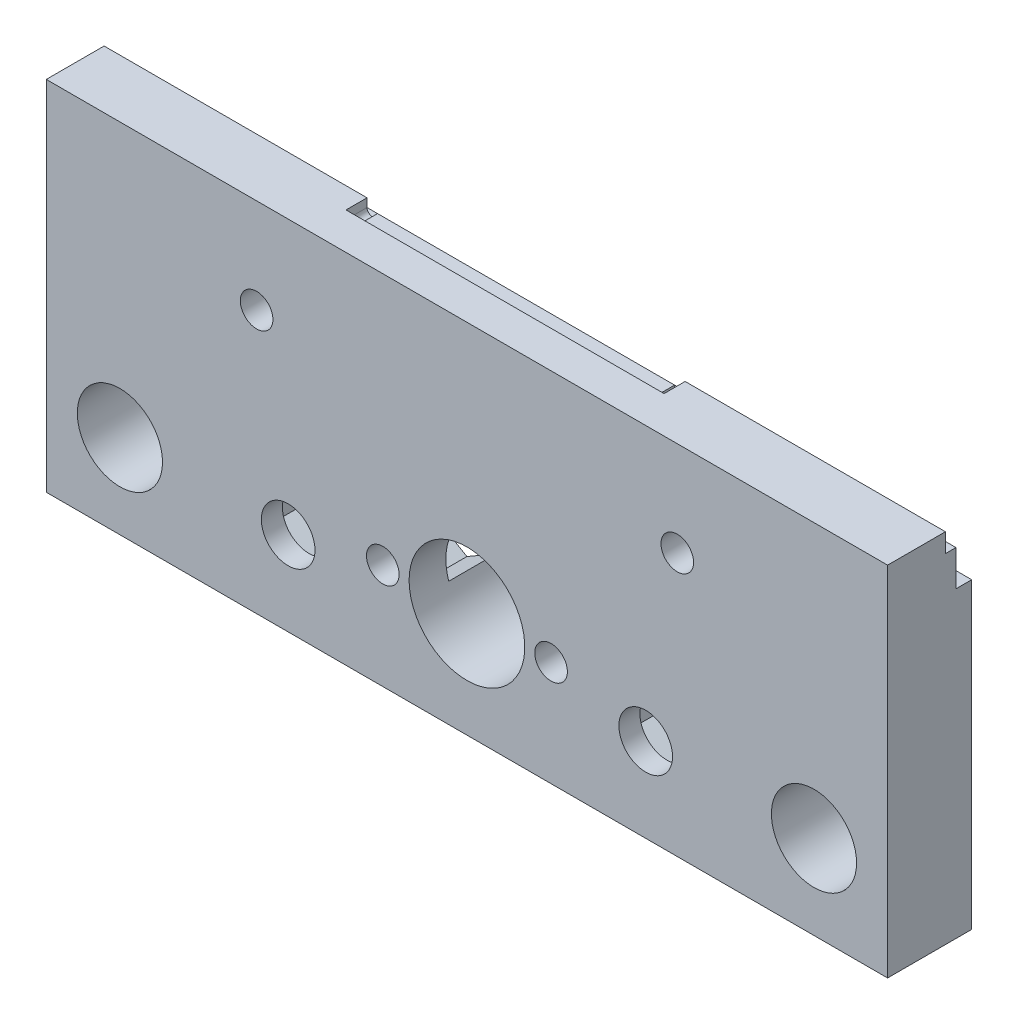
SolidWorks part; units mm, degrees
ref_plane "前视基准面" through (0, 0, 0) normal (0, 0, 1) x (1, 0, 0)
ref_plane "上视基准面" through (0, 0, 0) normal (0, 1, 0) x (1, 0, 0)
ref_plane "右视基准面" through (0, 0, 0) normal (1, 0, 0) x (0, 0, -1)
sketch "前视图草图" plane through (0, 0, 0) normal (0, 0, 1) x (1, 0, 0)
  line L0 (0, 0) -> (44.4821, 0) construction
  line L1 (0, 0) -> (0, 28.3185) construction
sketch "草图2" plane through (0, 0, 0) normal (0, 0, 1) x (1, 0, 0)
  line L0 (0, 0) -> (80, 0)
  line L1 (-200000, 0) -> (200044.4821, 0) construction
  line L2 (80, 0) -> (80, 34)
  line L3 (80, 34) -> (0, 34)
  line L4 (0, -200000) -> (0, 200028.3185) construction
  line L5 (0, 34) -> (0, 0)
  circle A0 centre (7, 8) radius 4.05
  circle A1 centre (40, 10) radius 4.05
  circle A2 centre (73, 8) radius 4.05
  dimension "D3" = 8
  dimension "D5" = 10
  dimension "D9" = 8.1
  dimension "D10" = 8.1
  dimension "D11" = 8.1
  dimension "D1" = 34
  dimension "D2" = 80
  dimension "D4" = 7
  dimension "D6" = 7
  dimension "D7" = 8
  dimension "D8" = 40
extrude "凸台-拉伸1" add sketch "草图2" along normal blind 8
sketch "草图3" plane through (0, 0, 8) normal (0, 0, 1) x (1, 0, 0)
  line L0 (16.088, 8) -> (31.4805, 8) construction
  line L1 (7, 8) -> (7, 16.8386) construction
  line L2 (73, 8) -> (73, 16.5917) construction
  line L4 (-200000, 0) -> (200044.4821, 0) construction
  circle A2 centre (23, 8) radius 2.55
  circle A3 centre (57, 8) radius 2.55
  dimension "D4" = 5.1
  dimension "D5" = 5.1
  dimension "D1" = 8
  dimension "D2" = 16
  dimension "D3" = 16
extrude "切除-拉伸1" cut sketch "草图3" against normal through all
sketch "草图4" plane through (80, 0, 0) normal (1, 0, 0) x (0, 0, -1)
  line L1 (0, -200000) -> (0, 200028.3185) construction
  line L2 (-1.5, 32.2) -> (-2.5, 32.2)
  line L3 (-2.5, 32.2) -> (-2.5, 34)
  line L4 (-8, 34) -> (0, 34) construction
  line L5 (-2.5, 34) -> (0, 34)
  line L6 (-1.5, 32.2) -> (-1.5, 28.8)
  line L7 (-1.5, 28.8) -> (0, 28.8)
  line L8 (0, 28.8) -> (0, 34)
  dimension "D1" = 3.4
  dimension "D2" = 2.5
  dimension "D3" = 1.5
  dimension "D4" = 1.8
extrude "切除-拉伸2" cut sketch "草图4" against normal through all
sketch "草图5" plane through (0, 0, 8) normal (0, 0, 1) x (1, 0, 0)
  line L0 (40, 10) -> (56.5376, 10) construction
  circle A0 centre (40, 10) radius 8 construction
  circle A1 centre (48, 10) radius 1.55
  circle A2 centre (32, 10) radius 1.55
  dimension "D1" = 3.1
  dimension "D2" = 3.1
  dimension "D3" = 16
extrude "切除-拉伸3" cut sketch "草图5" against normal through all
sketch "草图7" plane through (0, 0, 0) normal (0, 0, -1) x (-1, 0, 0)
  line L0 (-80, 0) -> (-80, 28.8) construction
  line L1 (-52.9, 5.6329) -> (-52.9, 10.3671)
  line L14 (-52.9, 10.3671) -> (-57, 12.7343)
  line L15 (-57, 12.7343) -> (-61.1, 10.3671)
  line L19 (-61.1, 10.3671) -> (-61.1, 5.6329)
  line L20 (-61.1, 5.6329) -> (-57, 3.2657)
  line L21 (-57, 3.2657) -> (-52.9, 5.6329)
  line L22 (-18.9, 5.6329) -> (-18.9, 10.3671)
  line L23 (-18.9, 10.3671) -> (-23, 12.7343)
  line L24 (-23, 12.7343) -> (-27.1, 10.3671)
  line L25 (-27.1, 10.3671) -> (-27.1, 5.6329)
  line L26 (-27.1, 5.6329) -> (-23, 3.2657)
  line L27 (-23, 3.2657) -> (-18.9, 5.6329)
  circle A6 centre (-57, 8) radius 4.1 construction
  circle A10 centre (-23, 8) radius 4.1 construction
  dimension "D1" = 8.2
sketch "草图8" plane through (0, 0, 0) normal (0, 0, -1) x (-1, 0, 0)
  line L0 (-80, 0) -> (-80, 28.8) construction
  line L1 (-45.15, 8.3546) -> (-45.15, 11.6454)
  line L5 (-45.15, 11.6454) -> (-48, 13.2909)
  line L6 (-48, 13.2909) -> (-50.85, 11.6454)
  line L7 (-50.85, 11.6454) -> (-50.85, 8.3546)
  line L8 (-50.85, 8.3546) -> (-48, 6.7091)
  line L9 (-48, 6.7091) -> (-45.15, 8.3546)
  line L10 (-29.15, 8.3546) -> (-29.15, 11.6454)
  line L11 (-29.15, 11.6454) -> (-32, 13.2909)
  line L12 (-32, 13.2909) -> (-34.85, 11.6454)
  line L13 (-34.85, 11.6454) -> (-34.85, 8.3546)
  line L14 (-34.85, 8.3546) -> (-32, 6.7091)
  line L15 (-32, 6.7091) -> (-29.15, 8.3546)
  circle A2 centre (-48, 10) radius 2.85 construction
  circle A3 centre (-32, 10) radius 2.85 construction
  dimension "D1" = 5.7
extrude "切除-拉伸5" cut sketch "草图8" against normal blind 4.5
sketch "草图11" plane through (0, 0, 0) normal (0, 0, -1) x (-1, 0, 0)
  line L0 (0, 34) -> (-80, 34) construction
  line L1 (-80, 0) -> (-80, 28.8) construction
  line L2 (0, -200000) -> (0, 200028.3185) construction
  line L3 (-40, 20) -> (-40, 13.5744) construction
  line L4 (-28.772, 25) -> (-45.9396, 25) construction
  circle A0 centre (-60, 25) radius 1.55
  circle A1 centre (-20, 25) radius 1.55
  point P23 (-40, 20)
  dimension "D1" = 3.1
  dimension "D2" = 3.1
  dimension "D3" = 20
  dimension "D4" = 20
  dimension "D5" = 9
sketch "草图20" plane through (0, 0, 0) normal (0, 0, -1) x (-1, 0, 0)
  circle A0 centre (-40, 10) radius 5.5
  dimension "D1" = 11
extrude "切除-拉伸7" cut sketch "草图11" against normal through all contours A0 | A1
sketch "草图12" plane through (0, 0, 0) normal (0, 0, -1) x (-1, 0, 0)
  line L0 (-62.5, 22.15) -> (-57.5, 22.15)
  line L1 (-57.5, 27.85) -> (-62.5, 27.85)
  line L4 (-80, 0) -> (-80, 28.8) construction
  line L5 (-39.1423, 25) -> (-43.2672, 25) construction
  line L6 (-60, 21) -> (-60, 25.2385) construction
  line L7 (-20, 21) -> (-20, 26.1603) construction
  line L8 (-40, 20) -> (-40, 24.3689) construction
  line L9 (-17.5, 27.85) -> (-22.5, 27.85)
  line L10 (-22.5, 22.15) -> (-17.5, 22.15)
  line L11 (0, -200000) -> (0, 200028.3185) construction
  line L12 (0, 34) -> (-80, 34) construction
  arc A0 (-62.5, 27.85) -> (-62.5, 22.15) centre (-62.5, 25) ccw
  arc A1 (-57.5, 22.15) -> (-57.5, 27.85) centre (-57.5, 25) ccw
  arc A4 (-17.5, 22.15) -> (-17.5, 27.85) centre (-17.5, 25) ccw
  arc A5 (-22.5, 27.85) -> (-22.5, 22.15) centre (-22.5, 25) ccw
  point P16 (-38, 21)
  point P28 (-40, 25)
  dimension "D2" = 20
  dimension "D3" = 5
  dimension "D4" = 2.5
  dimension "D5" = 20
  dimension "D6" = 9
  dimension "D1" = 2
sketch "草图19" plane through (0, 0, 2.5) normal (0, 0, -1) x (-1, 0, 0)
  line L0 (0, 34) -> (-80, 34) construction
  line L1 (-25, 34) -> (-55.2479, 34)
  line L2 (-25, 34) -> (-25, 33.2)
  line L3 (-26, 33.2) -> (-54.2479, 33.2)
  line L4 (-55.2479, 34) -> (-55.2479, 33.2)
  line L5 (0, -200000) -> (0, 200028.3185) construction
  line L7 (0, 32.2) -> (-80, 32.2) construction
  line L8 (-56.3335, 32.7) -> (-52.9089, 32.7) construction
  line L9 (-55.2479, 1028.5823) -> (-55.2479, 33.2) construction
  line L10 (-25, 1028.5823) -> (-25, 32.7) construction
  line L11 (-55.2479, 32.7) -> (-55.2479, -973.3) construction
  line L12 (-25, 32.7) -> (-25, -973.3) construction
  arc A3 (-55.2479, 33.2) -> (-54.2479, 33.2) centre (-54.7479, 33.2) ccw
  arc A6 (-26, 33.2) -> (-25, 33.2) centre (-25.5, 33.2) ccw
  dimension "D3" = 1
  dimension "D4" = 1
  dimension "D2" = 0.8
  dimension "D1" = 0.5
  dimension "D9" = 25
extrude "切除-拉伸11" cut sketch "草图19" against normal blind 2
extrude "切除-拉伸13" cut sketch "草图7" against normal blind 6
extrude "切除-拉伸14" cut sketch "草图20" against normal through all
